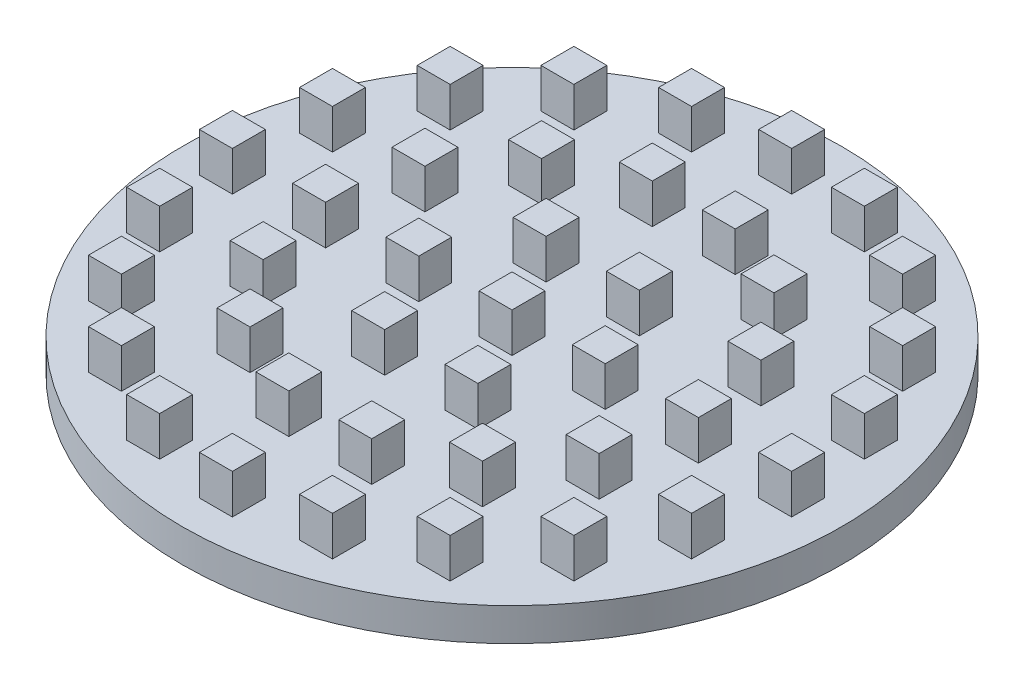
SolidWorks part; units mm, degrees
ref_plane "Front Plane" through (0, 0, 0) normal (0, 0, 1) x (1, 0, 0)
ref_plane "Top Plane" through (0, 0, 0) normal (0, 1, 0) x (1, 0, 0)
ref_plane "Right Plane" through (0, 0, 0) normal (1, 0, 0) x (0, 0, -1)
sketch "Sketch1" plane through (0, 0, 0) normal (0, 1, 0) x (1, 0, 0)
  circle A0 centre (0, 0) radius 127
  dimension "D1" = 254
extrude "Extrude1" add sketch "Sketch1" along normal blind 12.7
sketch "Sketch2" plane through (0, 12.7, 0) normal (0, 1, 0) x (1, 0, 0)
  line L1 (-6.35, 6.35) -> (6.35, 6.35)
  line L2 (-6.35, 6.35) -> (-6.35, -6.35)
  line L3 (-6.35, -6.35) -> (6.35, -6.35)
  line L4 (6.35, 6.35) -> (6.35, -6.35)
  dimension "D1" = 12.7
  dimension "D2" = 12.7
  dimension "D3" = 6.35
  dimension "D4" = 6.35
extrude "Extrude2" add sketch "Sketch2" along normal blind 15.24
other "Fill Pattern4" parameters "D4"=35.921, "D5"=35.921, "D3"=0
other "Fill Pattern1" parameters "D1"=22.7185, "D2"=60, "D3"=0
